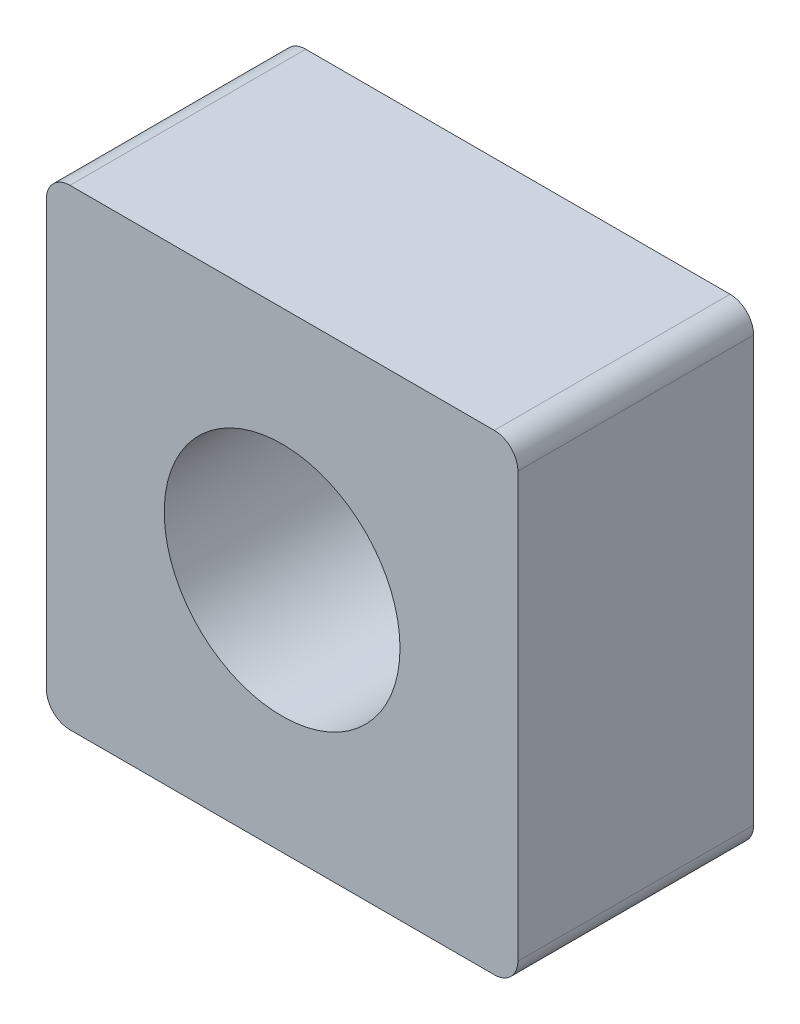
SolidWorks part; units mm, degrees
ref_plane "正面" through (0, 0, 0) normal (0, 0, 1) x (1, 0, 0)
ref_plane "平面" through (0, 0, 0) normal (0, 1, 0) x (1, 0, 0)
ref_plane "右側面" through (0, 0, 0) normal (1, 0, 0) x (0, 0, -1)
sketch "ｽｹｯﾁ1" plane through (0, 0, 0) normal (0, 0, 1) x (1, 0, 0)
  line L1 (-5, 5) -> (5, 5)
  line L2 (-5, 5) -> (-5, -5)
  line L3 (-5, -5) -> (5, -5)
  line L4 (5, 5) -> (5, -5)
  dimension "D1" = 5
  dimension "D2" = 10
  dimension "D3" = 5
  dimension "D4" = 10
extrude "押し出し1" add sketch "ｽｹｯﾁ1" along normal mid plane 5
hole_wizard "M6x1.0 ねじ穴1" positions "3Dｽｹｯﾁ1" profile "ｽｹｯﾁ3" tap size "M6x1.0" standard "JIS"
sketch3d "3Dｽｹｯﾁ1"
  line L0 (-5, 5, 2.5) -> (-5, -5, 2.5) construction
  line L1 (-5, -5, 2.5) -> (5, -5, 2.5) construction
  point P0 (0, 0, 2.5)
  dimension "D1" = 5
  dimension "D2" = 5
sketch "ｽｹｯﾁ3" plane through (0, 0, 2.5) normal (1, 0, 0) x (0, -1, 0)
  line L0 (0, 0) -> (0, 5)
  line L1 (0, 5) -> (2.5, 5)
  line L2 (2.5, 5) -> (2.5, 0)
  line L5 (2.5, 0) -> (0, 0)
  line L11 (0, -6.35) -> (0, 107.95) construction
  dimension "次ｻｰﾌｪｽまでのねじ下穴ﾄﾞﾘﾙの直径" = 5
  dimension "次ｻｰﾌｪｽまでのねじ下穴ﾄﾞﾘﾙの深さ" = 5
fillet "ﾌｨﾚｯﾄ1" radius 0.5 4 edges at (-5, 5, 0) (-5, -5, 0) (5, -5, 0) (5, 5, 0)
